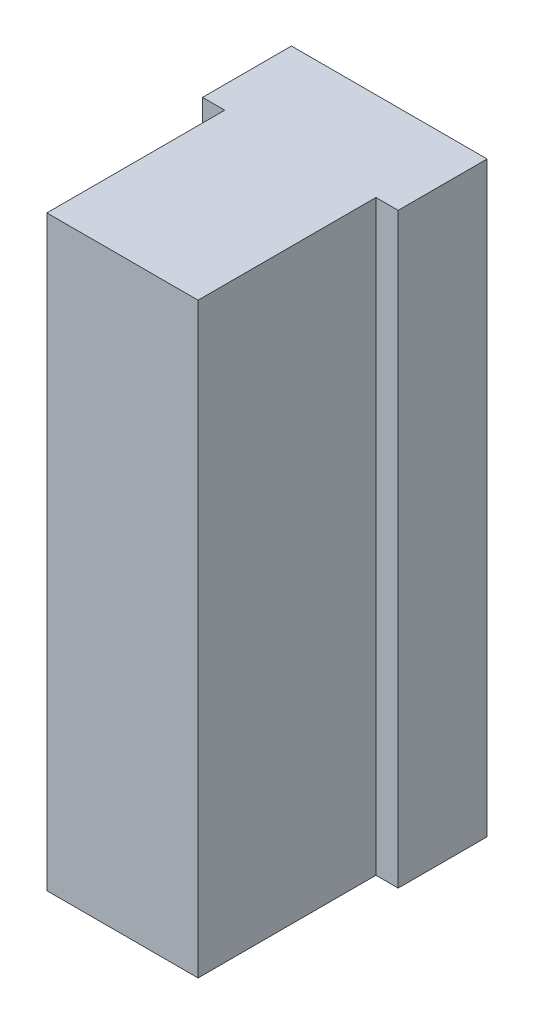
SolidWorks part; units mm, degrees
ref_plane "Front Plane" through (0, 0, 0) normal (0, 0, 1) x (1, 0, 0)
ref_plane "Top Plane" through (0, 0, 0) normal (0, 1, 0) x (1, 0, 0)
ref_plane "Right Plane" through (0, 0, 0) normal (1, 0, 0) x (0, 0, -1)
sketch "Sketch1" plane through (0, 0, 0) normal (0, 1, 0) x (1, 0, 0)
  line L0 (-3.7097, 13.3142) -> (-3.0747, 13.3142)
  line L1 (-8.0277, 8.2342) -> (-3.7097, 8.2342)
  line L2 (-8.0277, 8.2342) -> (-8.0277, 13.3142)
  line L4 (-3.7097, 8.2342) -> (-3.7097, 13.3142)
  line L5 (-8.6627, 15.8542) -> (-3.0747, 15.8542)
  line L6 (-8.6627, 15.8542) -> (-8.6627, 13.3142)
  line L7 (-8.6627, 13.3142) -> (-8.0277, 13.3142)
  line L8 (-3.0747, 15.8542) -> (-3.0747, 13.3142)
  dimension "D1" = 4.318
  dimension "D2" = 0.635
  dimension "D3" = 5.588
  dimension "D4" = 2.54
  dimension "D5" = 7.62
extrude "Extrude1" add sketch "Sketch1" along normal blind 16.764
